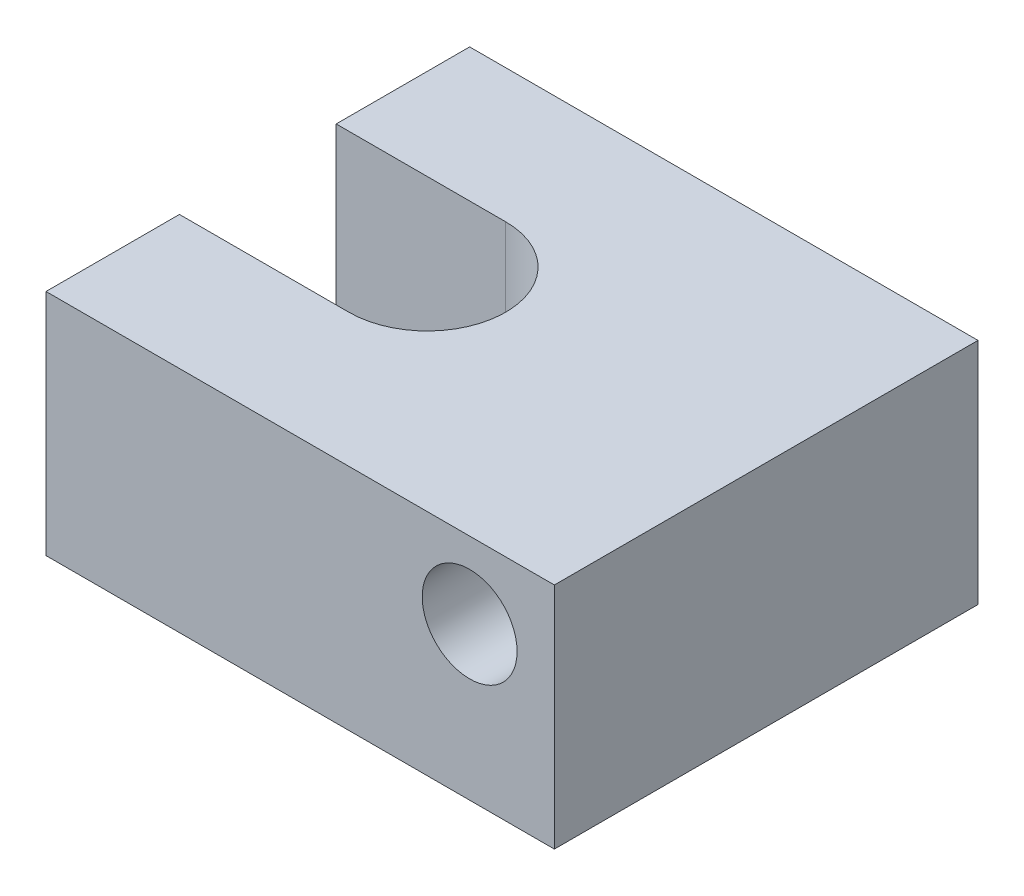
SolidWorks part; units mm, degrees
ref_plane "Front" through (0, 0, 0) normal (0, 0, 1) x (1, 0, 0)
ref_plane "Top" through (0, 0, 0) normal (0, 1, 0) x (1, 0, 0)
ref_plane "Right" through (0, 0, 0) normal (1, 0, 0) x (0, 0, -1)
sketch "Sketch1" plane through (0, 0, 0) normal (0, 0, 1) x (1, 0, 0)
  line L0 (-7.62, -3.429) -> (7.62, 3.429) construction
  line L1 (-7.62, 3.429) -> (7.62, 3.429)
  line L2 (-7.62, 3.429) -> (-7.62, -3.429)
  line L3 (-7.62, -3.429) -> (7.62, -3.429)
  line L4 (7.62, 3.429) -> (7.62, -3.429)
  dimension "D1" = 6.858
  dimension "D2" = 15.24
extrude "Base-Extrude" add sketch "Sketch1" against normal blind 12.7
sketch "Sketch2" plane through (0, 3.429, 0) normal (0, 1, 0) x (-1, 0, 0)
  line L0 (-7.62, 0) -> (7.62, 0) construction
  line L1 (-2.54, 0) -> (7.62, 0)
  line L2 (-2.54, 0) -> (-2.54, -12.7)
  line L3 (-2.54, -12.7) -> (7.62, -12.7)
  line L4 (7.62, 0) -> (7.62, -12.7)
  line L5 (7.62, -12.7) -> (7.62, 0) construction
  line L6 (-7.62, -12.7) -> (-7.62, 0) construction
  dimension "D1" = 5.08
  dimension "D2" = 12.7
extrude "Cut-Extrude1" [suppressed] cut sketch "Sketch2" against normal through all
hole_wizard "#4-40 Tapped Hole1" positions "Sketch4" profile "Sketch3" tap size "#4-40" standard "Ansi Inch"
sketch "Sketch4" plane through (0, 0, 0) normal (0, 0, 1) x (1, 0, 0)
  line L0 (5.08, 3.175) -> (5.08, -3.175) construction
  line L3 (7.62, -3.429) -> (7.62, 3.429) construction
  line L4 (-7.62, -3.429) -> (7.62, -3.429) construction
  point P0 (5.08, 1.143)
  dimension "D1" = 4.572
  dimension "D2" = 2.54
sketch "Sketch3" plane through (5.08, 1.143, 0) normal (1, 0, 0) x (0, -1, 0)
  line L0 (0, 0) -> (0, 13.3792)
  line L1 (0, 13.3792) -> (1.1303, 12.7)
  line L2 (1.1303, 12.7) -> (1.1303, 5.69)
  line L3 (1.1303, 5.69) -> (1.4224, 5.69)
  line L4 (1.4224, 5.69) -> (1.4224, 0)
  line L5 (1.4224, 0) -> (0, 0)
  line L10 (0, 13.3792) -> (-1.1303, 12.7) construction
  line L11 (0, -6.35) -> (0, 107.95) construction
  dimension "Tap Drill Dia." = 2.2606
  dimension "Tap Drill Depth" = 12.7
  dimension "Thread Dia." = 2.8448
  dimension "Thread Depth" = 5.69
  dimension "Drill Angle" = 118
sketch "Sketch5" plane through (0, 3.429, 0) normal (0, 1, 0) x (-1, 0, 0)
  line L0 (-13.9296, -6.35) -> (13.4924, -6.35) construction
  line L2 (7.62, -12.7) -> (7.62, 0) construction
  line L3 (2.54, -14.6275) -> (2.54, -23.5297) construction
  line L4 (2.54, -4.0005) -> (7.62, -4.0005)
  line L5 (2.54, -8.6995) -> (7.62, -8.6995)
  line L6 (7.62, -8.6995) -> (7.62, -4.0005)
  line L7 (-7.62, -12.7) -> (7.62, -12.7) construction
  arc A0 (2.54, -4.0005) -> (2.54, -8.6995) centre (2.54, -6.35) ccw
  dimension "D2" = 4.699
  dimension "D1" = 6.35
  dimension "D3" = 5.08
extrude "Cut-Extrude2" cut sketch "Sketch5" against normal through all
fillet "Fillet1" [suppressed] radius 2.54
sketch "Sketch6" [suppressed] plane through (0, 0, -12.7) normal (0, 0, 1) x (1, 0, 0)
  line L0 (7.62, 0.889) -> (-12.7, 0.889)
  line L1 (-12.7, -3.429) -> (-12.7, 3.429) construction
fillet "Fillet3" [suppressed] radius 2.54
sketch "Sketch7" [suppressed] plane through (0, 0, 0) normal (0, 0, 1) x (1, 0, 0)
  line L0 (7.62, -3.429) -> (7.62, 0.889) construction
  line L1 (2.9049, 6.5673) -> (8.255, 6.5673)
  line L2 (2.9049, 6.5673) -> (2.9049, -6.1427)
  line L3 (2.9049, -6.1427) -> (8.255, -6.1427)
  line L4 (8.255, 6.5673) -> (8.255, -6.1427)
  dimension "D1" = 0.635
extrude "Cut-Extrude3" [suppressed] cut sketch "Sketch7" against normal blind 5.08
fillet "Fillet4" [suppressed] radius 3.175
